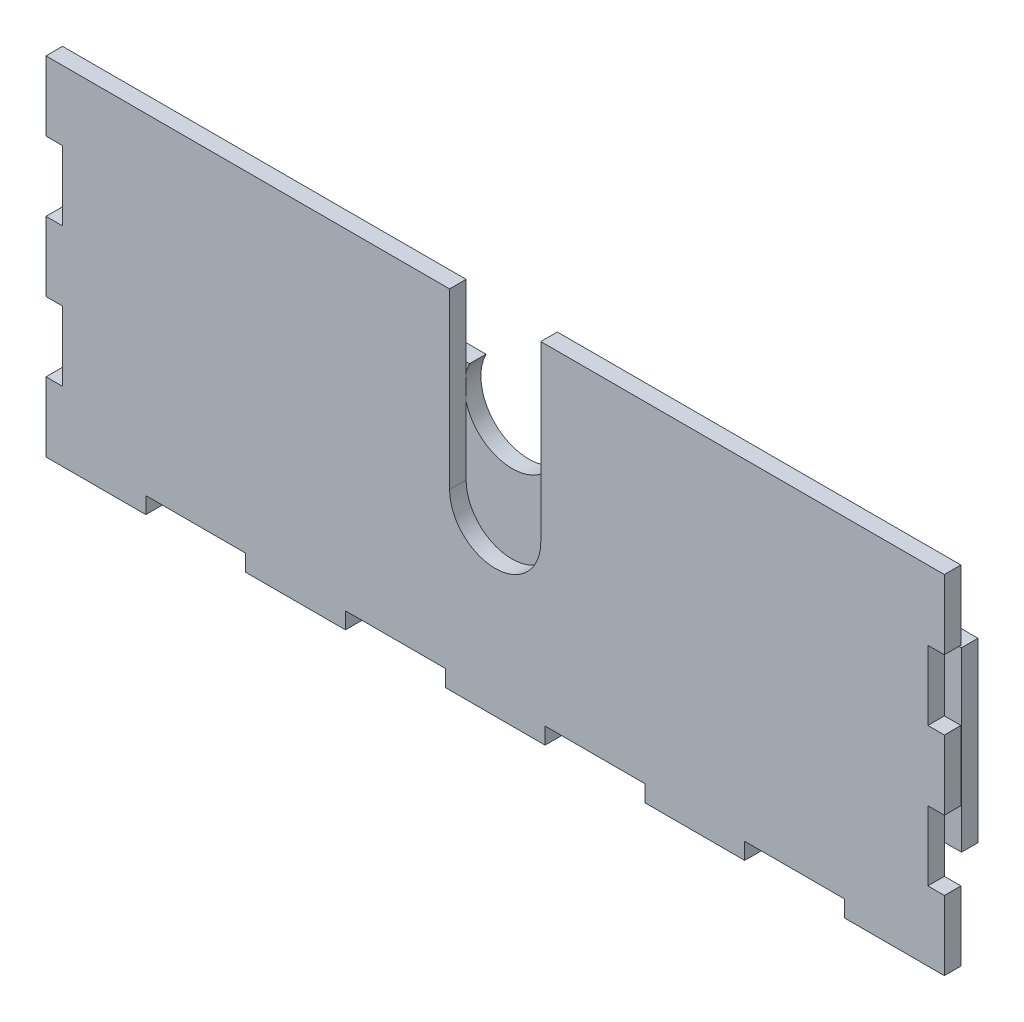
SolidWorks part; units mm, degrees
ref_plane "Front Plane" through (0, 0, 0) normal (0, 0, 1) x (1, 0, 0)
ref_plane "Top Plane" through (0, 0, 0) normal (0, 1, 0) x (1, 0, 0)
ref_plane "Right Plane" through (0, 0, 0) normal (1, 0, 0) x (0, 0, -1)
sketch "Sketch2" plane through (0, 0, 0) normal (0, 0, 1) x (1, 0, 0)
  line L0 (187.4231, 0) -> (0, 0)
  line L1 (226.7931, 0) -> (414.02, 0)
  line L2 (0, 0) -> (0, -81.548)
  line L3 (414.02, 0) -> (414.02, -81.548)
  line L4 (414.02, -81.548) -> (0, -81.548)
  arc A0 (226.7931, 0) -> (187.4231, 0) centre (207.1081, -9.9454) cw
  dimension "D1" = 414.02
  dimension "D2" = 81.548
  dimension "D3" = 39.37
extrude "Boss-Extrude1" add sketch "Sketch2" along normal blind 7.62
sketch "Sketch5" plane through (0, 0, 7.62) normal (0, 0, 1) x (1, 0, 0)
  line L1 (185.883, 32.8964) -> (185.883, -47.1036)
  line L2 (0, 32.8964) -> (0, 0.8964)
  line L3 (413.7613, 32.8964) -> (413.7613, 0.8964)
  line L4 (413.7613, 0.8964) -> (406.146, 0.8964)
  line L5 (0, 0.8964) -> (7.62, 0.8964)
  line L6 (7.62, 0.8964) -> (7.62, -31.1036)
  line L7 (7.62, -31.1036) -> (0, -31.1036)
  line L8 (0, -31.1036) -> (0, -63.1036)
  line L9 (0, -63.1036) -> (7.62, -63.1036)
  line L10 (7.62, -63.1036) -> (7.62, -95.1036)
  line L11 (7.62, -95.1036) -> (0, -95.1036)
  line L12 (0, -95.1036) -> (0, -127.1036)
  line L13 (406.146, 0.8964) -> (406.146, -31.1036)
  line L14 (406.146, -31.1036) -> (413.766, -31.1036)
  line L15 (413.766, -31.1036) -> (413.766, -63.1036)
  line L16 (413.766, -63.1036) -> (406.146, -63.1036)
  line L17 (406.146, -63.1036) -> (406.146, -95.1036)
  line L18 (406.146, -95.1036) -> (413.766, -95.1036)
  line L19 (413.766, -95.1036) -> (413.766, -127.1036)
  line L20 (413.766, -127.1036) -> (367.792, -127.1036)
  line L21 (367.792, -127.1036) -> (367.792, -119.4836)
  line L22 (367.792, -119.4836) -> (321.818, -119.4836)
  line L23 (321.818, -119.4836) -> (321.818, -127.1036)
  line L24 (321.818, -127.1036) -> (275.844, -127.1036)
  line L25 (275.844, -127.1036) -> (275.844, -119.4836)
  line L26 (275.844, -119.4836) -> (229.87, -119.4836)
  line L27 (229.87, -119.4836) -> (229.87, -127.1036)
  line L28 (229.87, -127.1036) -> (183.896, -127.1036)
  line L29 (183.896, -127.1036) -> (183.896, -119.4836)
  line L30 (183.896, -119.4836) -> (137.922, -119.4836)
  line L31 (137.922, -119.4836) -> (137.922, -127.1036)
  line L32 (137.922, -127.1036) -> (91.948, -127.1036)
  line L33 (91.948, -127.1036) -> (91.948, -119.4836)
  line L34 (91.948, -119.4836) -> (45.974, -119.4836)
  line L35 (45.974, -119.4836) -> (45.974, -127.1036)
  line L36 (45.974, -127.1036) -> (0, -127.1036)
  line L37 (227.883, 32.8964) -> (227.883, -47.1036)
  line L38 (413.7613, 32.8964) -> (227.883, 32.8964)
  line L40 (185.883, 32.8964) -> (0, 32.8964)
  arc A0 (185.883, -47.1036) -> (227.883, -47.1036) centre (206.883, -47.1036) ccw
  dimension "D22" = 7.62
  dimension "D23" = 42
  dimension "D3" = 32
  dimension "D4" = 32
  dimension "D5" = 32
  dimension "D6" = 32
  dimension "D7" = 32
  dimension "D8" = 32
  dimension "D9" = 32
  dimension "D10" = 32
  dimension "D11" = 32
  dimension "D12" = 32
  dimension "D13" = 45.974
  dimension "D14" = 45.974
  dimension "D15" = 45.974
  dimension "D16" = 45.974
  dimension "D17" = 45.974
  dimension "D18" = 45.974
  dimension "D19" = 45.974
  dimension "D20" = 45.974
  dimension "D21" = 45.974
  dimension "D24" = 7.62
  dimension "D25" = 7.62
  dimension "D26" = 7.6153
  dimension "D27" = 7.62
  dimension "D28" = 7.62
  dimension "D29" = 7.62
extrude "Boss-Extrude5" add sketch "Sketch5" along normal blind 7.62 separate body
